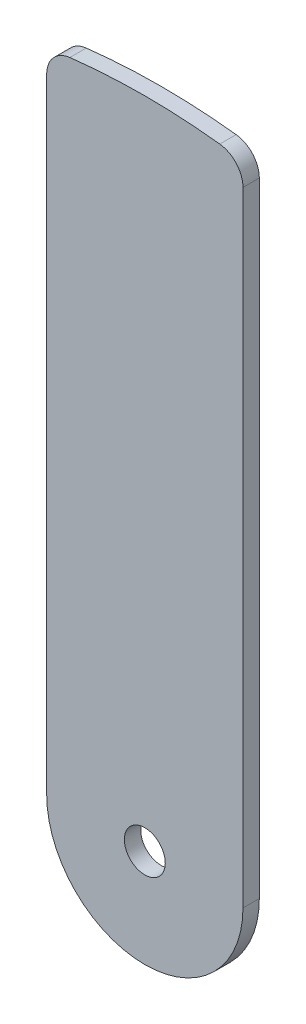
SolidWorks part; units mm, degrees
ref_plane "Front Plane" through (0, 0, 0) normal (0, 0, 1) x (1, 0, 0)
ref_plane "Top Plane" through (0, 0, 0) normal (0, 1, 0) x (1, 0, 0)
ref_plane "Right Plane" through (0, 0, 0) normal (1, 0, 0) x (0, 0, -1)
sketch "Sketch1" plane through (0, 0, 0) normal (0, 0, 1) x (1, 0, 0)
  line L1 (-19.05, 0) -> (19.05, 0)
  line L2 (-19.05, 0) -> (-19.05, 127)
  line L3 (-19.05, 127) -> (19.05, 127)
  line L4 (19.05, 0) -> (19.05, 127)
  line L5 (-6.35, 127) -> (6.35, 127)
  line L6 (-6.35, 127) -> (-6.35, 12.7)
  line L7 (-6.35, 12.7) -> (6.35, 12.7)
  line L8 (6.35, 127) -> (6.35, 12.7)
  circle A0 centre (0, 0) radius 3.9688
  circle A1 centre (0, 0) radius 19.05
  arc A2 (-6.35, 12.7) -> (6.35, 12.7) centre (0, 12.7) ccw
  circle A3 centre (0, 0) radius 127
  point P8 (0, 12.7)
  point P13 (0, 127)
  dimension "D1" = 7.9375
  dimension "D2" = 38.1
  dimension "D6" = 254
  dimension "D3" = 127
  dimension "D4" = 114.3
  dimension "D5" = 12.7
extrude "Boss-Extrude1" add sketch "Sketch1" along normal blind 3.175 contours L6 A3 L2 A1 | L4 A3 L8 A1 | L8 A3 L6 A1 | A2 L6 A1 L1 A0 L8 | L7 A2 | L8 A1 L6 L7 | L1 A1 A0
fillet "Fillet1" radius 5.08 2 edges at (-19.05, 125.5631, 1.5875) (19.05, 125.5631, 1.5875)
